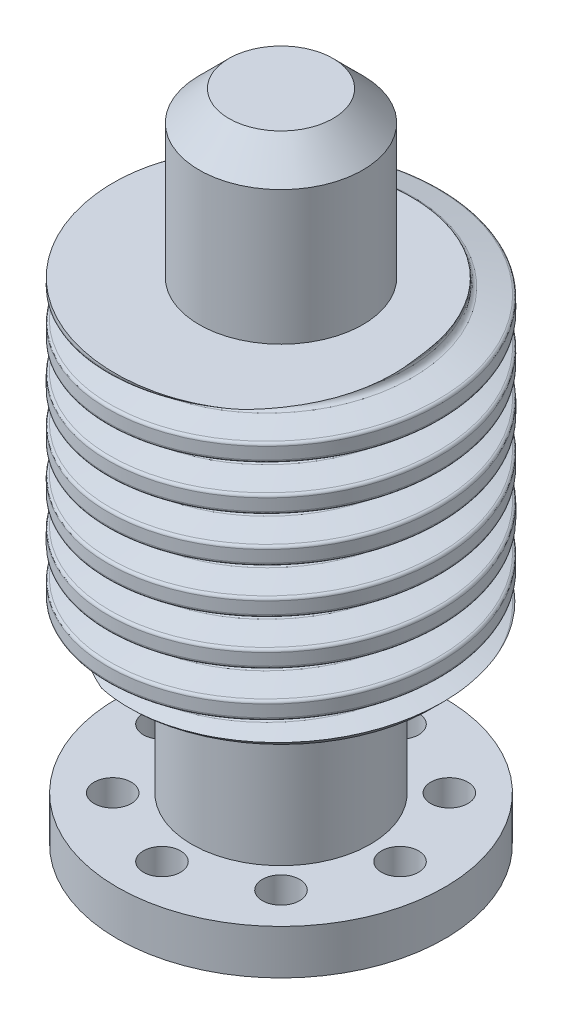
SolidWorks part; units mm, degrees
ref_plane "Front" through (0, 0, 0) normal (0, 0, 1) x (1, 0, 0)
ref_plane "Top" through (0, 0, 0) normal (0, 1, 0) x (1, 0, 0)
ref_plane "Right" through (0, 0, 0) normal (1, 0, 0) x (0, 0, -1)
imported_body "mx28-retain-1-solid1"
imported_body "worm_with_ring 2-1-solid1"
chamfer "Chamfer1" distance 2 angle 45
